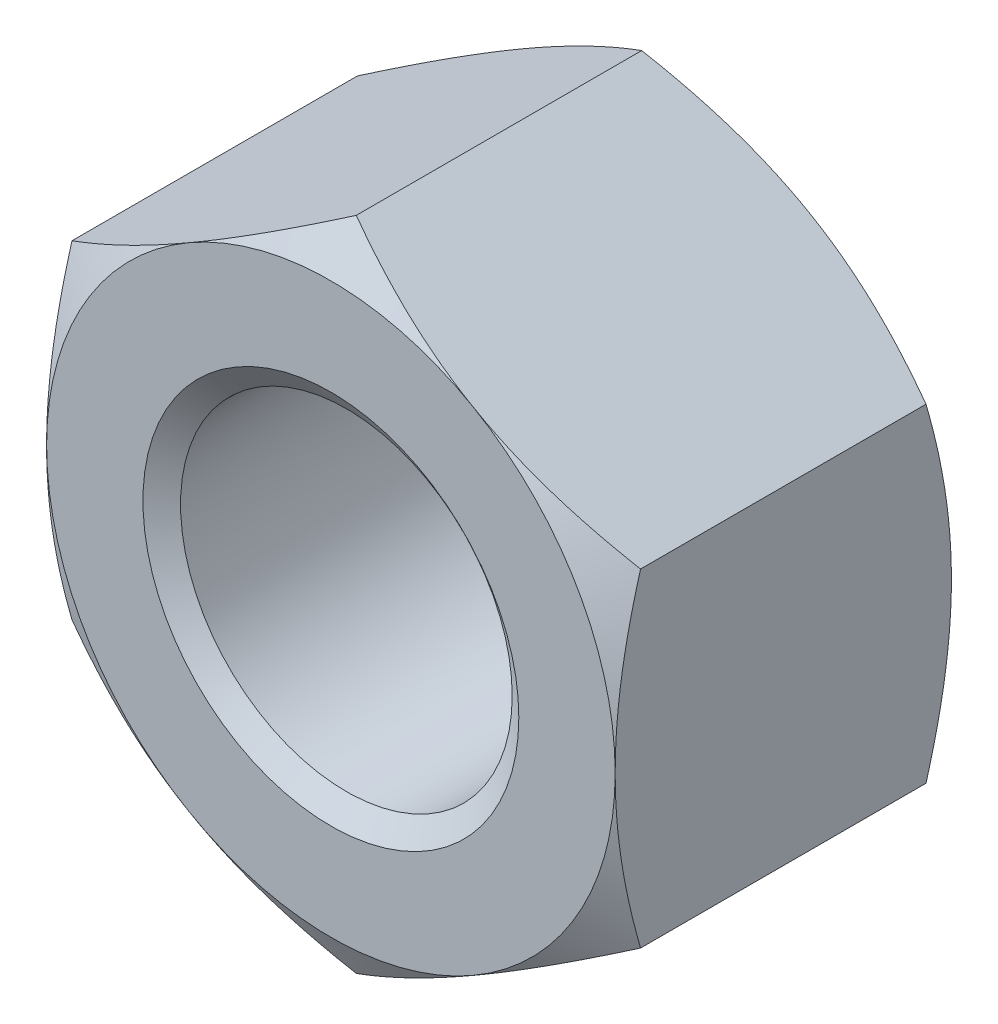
SolidWorks part; units mm, degrees
ref_plane "Plane1" through (0, 0, 0) normal (0, 0, 1) x (1, 0, 0)
ref_plane "Plane2" through (0, 0, 0) normal (0, 1, 0) x (1, 0, 0)
ref_plane "Plane3" through (0, 0, 0) normal (1, 0, 0) x (0, 0, -1)
sketch "BaseNutSke" plane through (0, 0, 0) normal (0, 0, 1) x (1, 0, 0)
  line L6 (19.05, 10.9985) -> (19.05, -10.9985)
  line L7 (-19.05, 10.9985) -> (-19.05, -10.9985)
  line L8 (19.05, 10.9985) -> (0, 21.997)
  line L9 (0, 21.997) -> (-19.05, 10.9985)
  line L10 (-19.05, -10.9985) -> (0, -21.997)
  line L11 (0, -21.997) -> (19.05, -10.9985)
  circle A0 centre (0, 0) radius 11.1125
  dimension "D4" = 19.05
  dimension "Tap_drill" = 22.225
  dimension "D1" = 120
  dimension "D2" = 19.05
  dimension "D3" = 19.05
  dimension "Width_flats" = 38.1
extrude "BaseNut" add sketch "BaseNutSke" against normal blind 22.5298
sketch "Sketch4" plane through (0, 0, 0) normal (1, 0, 0) x (0, 0, -1)
  line L0 (22.5298, 19.05) -> (22.1234, 19.05)
  line L1 (22.5298, 19.05) -> (22.5298, 31.997)
  line L2 (22.1234, 31.997) -> (22.5298, 31.997)
  line L3 (22.1234, 31.997) -> (22.1234, 19.05)
  line L4 (0, 0) -> (34.925, 0) construction
  line L6 (22.5298, 10.9985) -> (22.5298, 21.997) construction
  line L7 (0, 19.05) -> (-10, 19.05)
  line L8 (0, 10.9985) -> (0, 21.997) construction
  line L9 (1.7015, 21.997) -> (1.7015, 31.997)
  line L10 (1.7015, 31.997) -> (-10, 31.997)
  line L11 (-10, 31.997) -> (-10, 19.05)
  line L12 (0, 19.05) -> (1.7015, 21.997)
  line L14 (0, 10.9985) -> (0, -10.9985) construction
  line L15 (22.5298, 21.997) -> (0, 21.997) construction
  dimension "D1" = 19.05
  dimension "D2" = 30
  dimension "Bearing_ht" = 0.4064
  dimension "D3" = 10
  dimension "D4" = 10
revolve "Bearing-Face" [suppressed] cut sketch "Sketch4" angle 360 about L4
sketch "Sketch3" plane through (0, 0, 0) normal (1, 0, 0) x (0, 0, -1)
  line L0 (22.5298, 19.05) -> (20.8283, 21.997)
  line L1 (20.8283, 21.997) -> (20.8283, 31.997)
  line L2 (20.8283, 31.997) -> (32.5298, 31.997)
  line L3 (32.5298, 31.997) -> (32.5298, 19.05)
  line L4 (32.5298, 19.05) -> (22.5298, 19.05)
  line L5 (22.5298, 10.9985) -> (22.5298, 21.997) construction
  line L6 (22.5298, 21.997) -> (0, 21.997) construction
  line L7 (0, 0) -> (38.6776, 0) construction
  line L8 (22.5298, 0) -> (0, 0) construction
  line L9 (11.2649, 21.997) -> (11.2649, 44.222) construction
  line L10 (1.7015, 31.997) -> (-10, 31.997)
  line L11 (-10, 31.997) -> (-10, 19.05)
  line L12 (-10, 19.05) -> (0, 19.05)
  line L13 (0, 19.05) -> (1.7015, 21.997)
  line L14 (1.7015, 21.997) -> (1.7015, 31.997)
  line L16 (22.5298, 21.997) -> (0, 21.997) construction
  dimension "D1" = 19.05
  dimension "D2" = 30
  dimension "D3" = 10
  dimension "D4" = 10
revolve "Double-Chamfer" cut sketch "Sketch3" angle 360 about L7
sketch "ThdSchSke" plane through (0, 0, 0) normal (0, 1, 0) x (1, 0, 0)
  line L0 (-13.3797, 1.5875) -> (-11.1125, 3.175)
  line L1 (-11.1125, 3.175) -> (-2.7781, 3.175)
  line L2 (-2.7781, 3.175) -> (-2.7781, 0)
  line L3 (-2.7781, 0) -> (-11.1125, 0)
  line L4 (-11.1125, 0) -> (-13.3797, 1.5875)
  line L5 (-3.175, 3.175) -> (3.175, 3.175) construction
  line L6 (0, 3.175) -> (0, -2.9874) construction
  line L7 (0, 22.5298) -> (0, 0) construction
  dimension "VeeAngle" = 70
  dimension "SideAngle" = 55
  dimension "OverCut" = 5.5562
  dimension "Advance" = 3.175
chamfer "Chamfer1" distance 1.4817 angle 35 2 edges at (11.1125, 0, -22.5298) (11.1125, 0, 0)
revolve "ThreadSchematic" [suppressed] cut sketch "ThdSchSke" angle 360 about L6
pattern_linear "ThdSchPat" [suppressed]
equation "\"D2@BaseNutSke\" = \"Width_flats@BaseNutSke\" / 2"
equation "\"D3@BaseNutSke\" = \"Width_flats@BaseNutSke\" / 2"
equation "\"D1@Sketch3\" = \"Width_flats@BaseNutSke\" /2"
equation "\"D1@Sketch4\" = \"D2@BaseNutSke\""
equation "\"D4@BaseNutSke\" = \"D3@BaseNutSke\""
equation "\"OverCut@ThdSchSke\" = \"Tap_drill@BaseNutSke\"/4"
equation "\"Advance@ThdSchPat\" =\"Advance@ThdSchSke\""
equation "\"D1@Chamfer1\" = \"Tap_drill@BaseNutSke\"/15"
equation "\"Num_threads@ThdSchPat\" =  int( \"Thickness@BaseNut\" / \"Advance@ThdSchSke\" ) "
